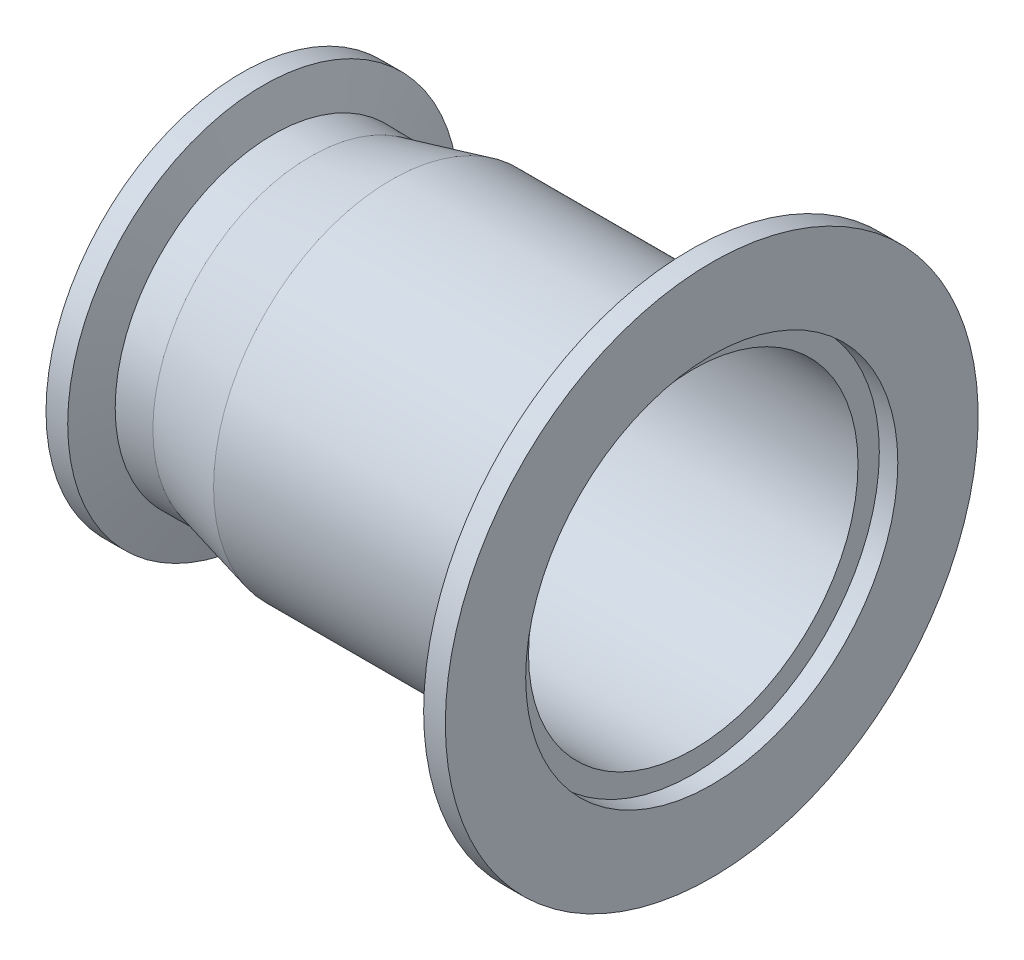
SolidWorks part; units mm, degrees
ref_plane "Front Plane" through (0, 0, 0) normal (0, 0, 1) x (1, 0, 0)
ref_plane "Top Plane" through (0, 0, 0) normal (0, 1, 0) x (1, 0, 0)
ref_plane "Right Plane" through (0, 0, 0) normal (1, 0, 0) x (0, 0, -1)
sketch "Sketch1" plane through (0, 0, 0) normal (0, 1, 0) x (1, 0, 0)
  line L0 (3.0624, 12.797) -> (6.1124, 12.797)
  line L1 (6.1124, 12.797) -> (7.5224, 7.527)
  line L2 (7.5224, 7.527) -> (12.7624, 7.467)
  line L3 (12.7624, 7.467) -> (24.1051, 10.277)
  line L4 (24.1051, 10.277) -> (64.1051, 10.277)
  line L5 (3.0624, 12.797) -> (3.0624, 5.897)
  line L6 (3.0624, 5.897) -> (5.6624, 5.897)
  line L7 (5.6624, 5.897) -> (5.6624, 2.897)
  line L8 (5.6624, 2.897) -> (28.146, 8.467)
  line L9 (28.146, 8.467) -> (66.5851, 8.467)
  line L10 (5.6624, 2.897) -> (5.6624, -14.698)
  line L12 (64.1051, 10.277) -> (64.1051, 15.187)
  line L13 (64.1051, 15.187) -> (66.1351, 22.767)
  line L14 (66.1351, 22.767) -> (69.1851, 22.767)
  line L15 (69.1851, 22.767) -> (69.1851, 11.467)
  line L16 (69.1851, 11.467) -> (66.5851, 11.467)
  line L17 (66.5851, 11.467) -> (66.5851, 8.467)
  line L18 (0, -14.698) -> (60.4818, -14.698)
  point P2 (0, 0)
revolve "Revolve3" add sketch "Sketch1" angle 360 about L18
